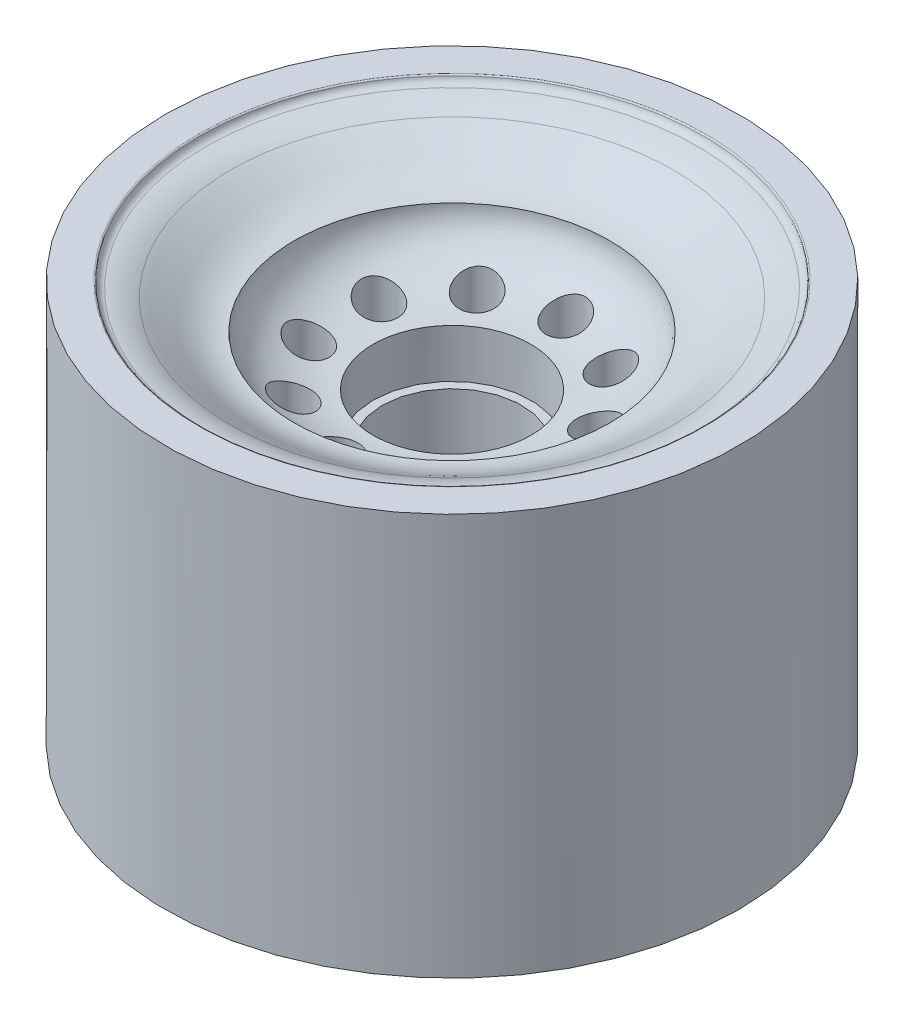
SolidWorks part; units mm, degrees
ref_plane "Front Plane" through (0, 0, 0) normal (0, 0, 1) x (1, 0, 0)
ref_plane "Top Plane" through (0, 0, 0) normal (0, 1, 0) x (1, 0, 0)
ref_plane "Right Plane" through (0, 0, 0) normal (1, 0, 0) x (0, 0, -1)
sketch "Sketch2" plane through (0, 0, 0) normal (0, 0, 1) x (1, 0, 0)
  line L1 (35.3082, 18.6628) -> (40, 18.6628)
  line L2 (0, 18.6628) -> (0, -37.3372)
  line L3 (0, -37.3372) -> (40, -37.3372)
  line L4 (40, 18.6628) -> (40, -37.3372)
  line L6 (0, 5.4128) -> (0, -18.3372)
  line L8 (11, 5.4128) -> (11, -1.3372)
  line L9 (11, -1.3372) -> (9.75, -1.3372)
  line L11 (11, -11.5872) -> (9.75, -11.5872)
  line L12 (9.75, -1.3372) -> (9.75, -11.5872)
  line L13 (40, 18.6628) -> (22, 18.6628)
  line L14 (40, 18.6628) -> (40, 12.4128)
  line L16 (22, 18.6628) -> (22, 12.4128)
  line L17 (35.125, 18.6628) -> (34.125, 18.6628)
  line L18 (22, -25.3372) -> (23.3, -25.3372)
  line L19 (34.1929, 17.6628) -> (34.125, 17.6628)
  line L20 (23.3, -25.3372) -> (25.5, -33.8372)
  line L21 (29.0053, -36.9533) -> (40, -37.3372)
  line L22 (25.5, -33.8372) -> (25.5991, -34.2201)
  line L23 (11, -11.5872) -> (11, -18.3372)
  arc A0 (34.2569, 17.6715) -> (35.111, 18.4961) centre (34.125, 18.6628) ccw
  arc A1 (34.2569, 17.6715) -> (30.8298, 16.5607) centre (35.5764, 7.759) ccw
  arc A2 (35.3082, 18.6628) -> (35.111, 18.4961) centre (35.3082, 18.4628) ccw
  arc A3 (29.0053, -36.9533) -> (25.5991, -34.2201) centre (29.1327, -33.3055) cw
  ellipse E0 centre (11, 12.4128) end of major axis (22, 12.4128) minor radius 7 (11, 5.4128) -> (22, 12.4128) ccw
  ellipse E1 centre (11, -25.3372) end of major axis (0, -25.3372) minor radius 7 (11, -18.3372) -> (22, -25.3372) cw
  spline S0 degree 3 poles (22, 12.4128) (25.3541, 12.4518) (27.7722, 14.8191) (30.6261, 16.4508) (30.8298, 16.5607) knots 0 0 0 0 0.687314 0.739788 0.739788 0.739788 0.739788
  point P15 (35.125, 18.6628)
  point P42 (25.5, -33.8372)
  point P44 (29.0067, -36.9533)
  dimension "D13" = 10
  dimension "D2" = 0.2
  dimension "D20" = 3.65
  dimension "D3" = 6.75
  dimension "D4" = 11
  dimension "D5" = 6.75
  dimension "D6" = 56
  dimension "D8" = 1.25
  dimension "D9" = 18
  dimension "D10" = 6.25
  dimension "D11" = 4.875
  dimension "D12" = 23.75
  dimension "D14" = 56
  dimension "D15" = 16.7
  dimension "D16" = 14.5
  dimension "D17" = 3.5
  dimension "D18" = 2
  dimension "D19" = 11
revolve "Revolve1" add sketch "Sketch2" angle 360 about L2
sketch "Sketch3" plane through (0, -25.3372, 0) normal (0, -1, 0) x (1, 0, 0)
  circle A1 centre (0, -15.85) radius 2.75
  circle A2 centre (-9.3164, -12.8229) radius 2.75
  circle A3 centre (-15.0742, -4.8979) radius 2.75
  circle A4 centre (-15.0742, 4.8979) radius 2.75
  circle A5 centre (-9.3164, 12.8229) radius 2.75
  circle A6 centre (0, 15.85) radius 2.75
  circle A7 centre (9.3164, 12.8229) radius 2.75
  circle A8 centre (15.0742, 4.8979) radius 2.75
  circle A9 centre (15.0742, -4.8979) radius 2.75
  circle A10 centre (9.3164, -12.8229) radius 2.75
  point P0 (0, 0)
  point P25 (0, 0)
  dimension "D1" = 15.85
  dimension "D2" = 10
  dimension "D3" = 5.5
extrude "Cut-Extrude1" cut sketch "Sketch3" against normal through all
